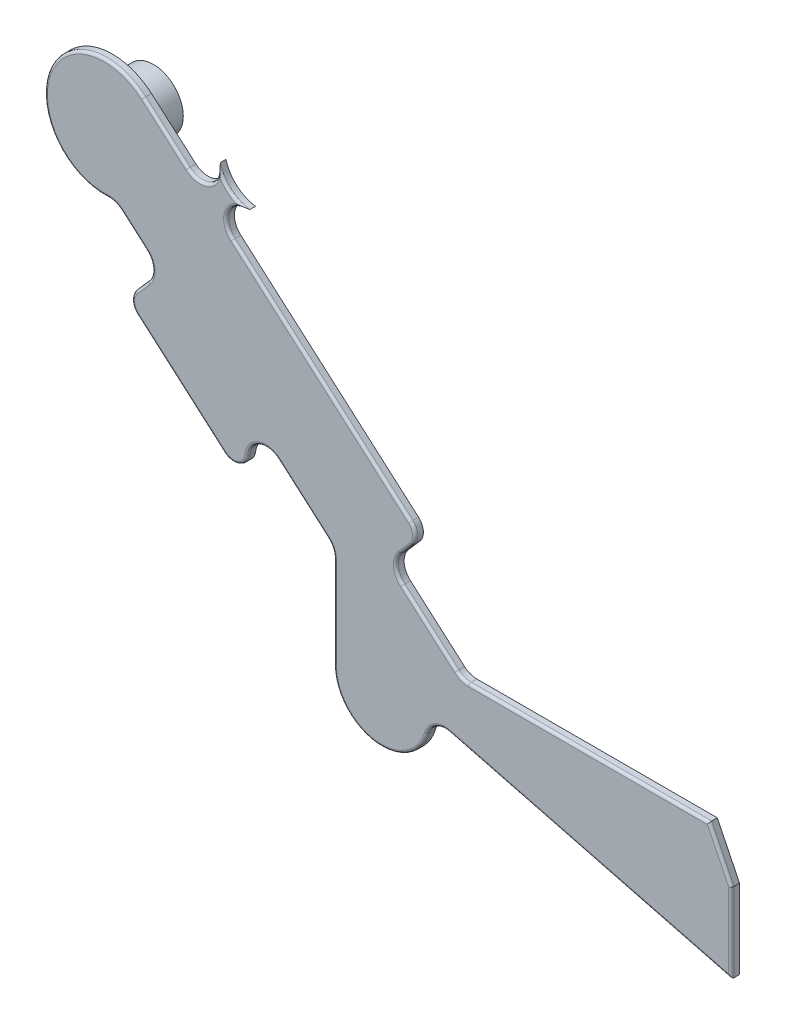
SolidWorks part; units mm, degrees
ref_plane "Front" through (0, 0, 0) normal (0, 0, 1) x (1, 0, 0)
ref_plane "Top" through (0, 0, 0) normal (0, 1, 0) x (1, 0, 0)
ref_plane "Right" through (0, 0, 0) normal (1, 0, 0) x (0, 0, -1)
mirrored part "MirrorCover Plate_Mirrored"
other "<MirrorCover Plate>-<<Cover Plate>-<Fillet1>>"
